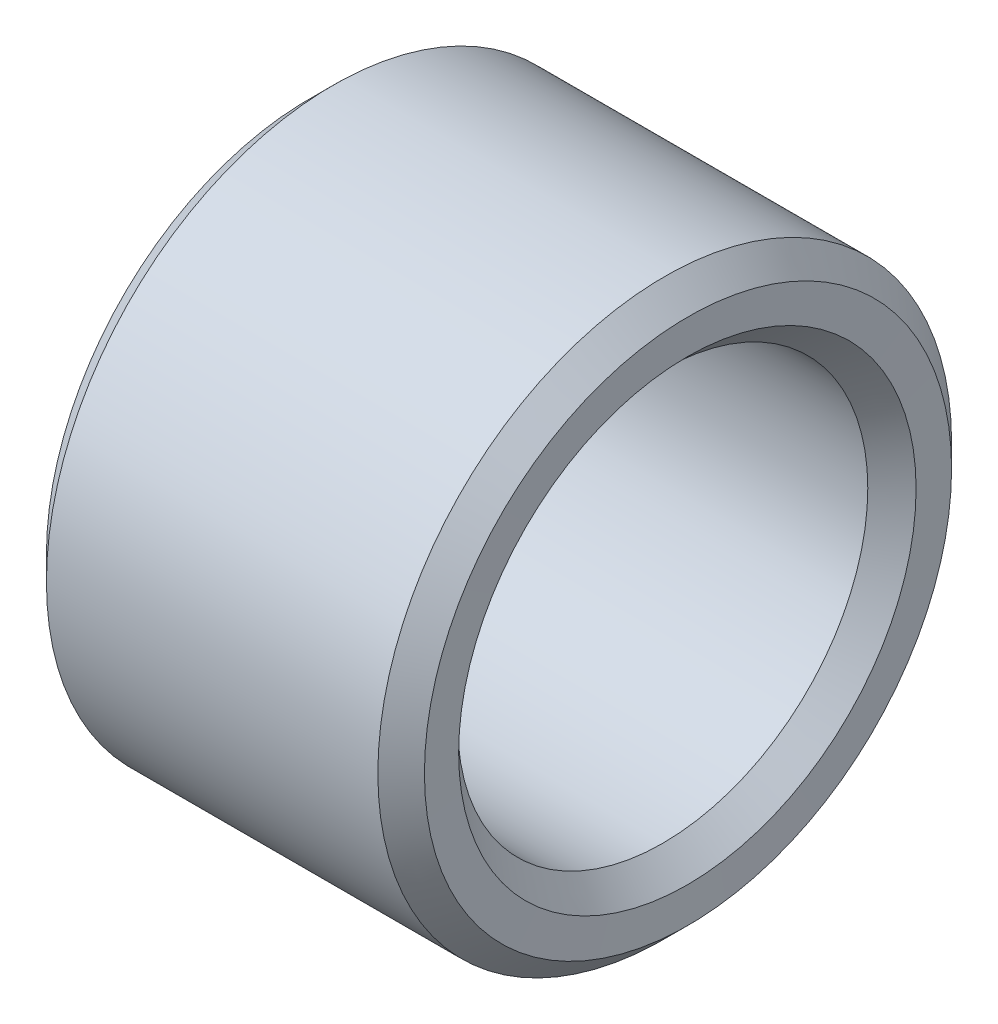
SolidWorks part; units mm, degrees
ref_plane "Plan de face" through (0, 0, 0) normal (0, 0, 1) x (1, 0, 0)
ref_plane "Plan de dessus" through (0, 0, 0) normal (0, 1, 0) x (1, 0, 0)
ref_plane "Plan de droite" through (0, 0, 0) normal (1, 0, 0) x (0, 0, -1)
sketch "Esquisse1" plane through (0, 0, 0) normal (0, 0, 1) x (1, 0, 0)
  line L0 (-305, -82.1405) -> (-335.2724, -82.1405) construction
  line L1 (-305, -77.1405) -> (-305, -87.1405) construction
  line L4 (-332.2724, -77.8179) -> (-332.2724, -76.0923)
  line L5 (-332.2724, -77.8179) -> (-332.2724, -62.9416) construction
  line L6 (-324.3163, -77.8179) -> (-332.2724, -77.8179)
  line L7 (-332.2724, -76.0923) -> (-324.2848, -76.0923)
  line L9 (-324.3163, -77.8179) -> (-324.2848, -76.0923)
revolve "Révolution2" add sketch "Esquisse1" angle 360 about L0
chamfer "Chanfrein1" distance 0.5 angle 45 4 edges at (-324.2848, -82.1405, -6.0482) (-324.3163, -82.1405, -4.3226) (-332.2724, -82.1405, -4.3226) (-332.2724, -82.1405, -6.0482)
